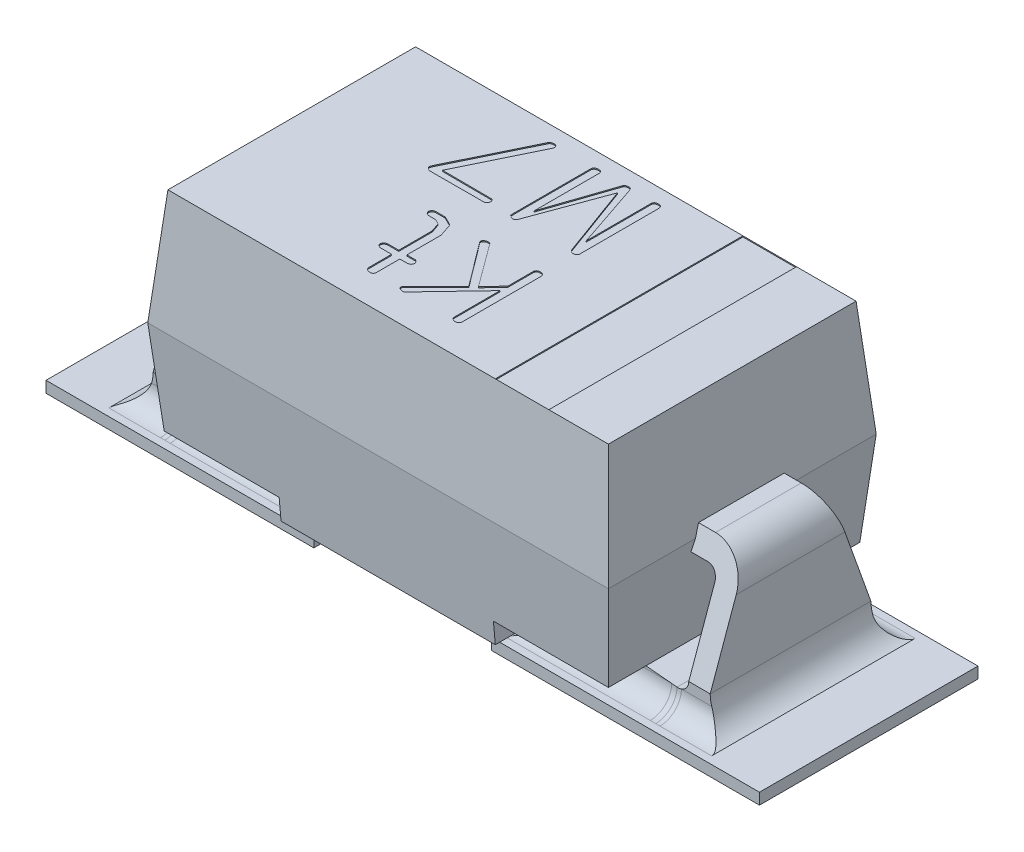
SolidWorks part; units mm, degrees
ref_plane "Front Plane" through (0, 0, 0) normal (0, 0, 1) x (1, 0, 0)
ref_plane "Top Plane" through (0, 0, 0) normal (0, 1, 0) x (1, 0, 0)
ref_plane "Right Plane" through (0, 0, 0) normal (1, 0, 0) x (0, 0, -1)
sketch "Sketch5" plane through (0, 0, 0) normal (0, 0, 1) x (1, 0, 0)
  line L2 (-2.3, 1.28) -> (2.3, 1.28)
  line L3 (2.5, 1.08) -> (2.5, 0.4)
  line L4 (2.2817, 0.2008) -> (1.2, 0.3)
  line L5 (0, -1.193) -> (0, 1.193) construction
  line L6 (1.375, 0) -> (-1.375, 0) construction
  line L7 (2.3, 0.4) -> (2.3, 0.2) construction
  line L10 (-2.5, 1.08) -> (-2.5, 0.4)
  line L11 (-2.2817, 0.2008) -> (-1.2, 0.3)
  arc A0 (2.3, 1.28) -> (2.5, 1.08) centre (2.3, 1.08) cw
  arc A1 (2.5, 0.4) -> (2.2817, 0.2008) centre (2.3, 0.4) cw
  arc A2 (-2.5, 0.4) -> (-2.2817, 0.2008) centre (-2.3, 0.4) ccw
  arc A4 (-2.3, 1.28) -> (-2.5, 1.08) centre (-2.3, 1.08) ccw
  point P15 (2.5, 0.1808)
  dimension "D8" = 0.2
  dimension "D1" = 0.2
  dimension "D2" = 2.5
  dimension "D3" = 1.28
  dimension "D4" = 0.2
  dimension "D5" = 0.3
  dimension "D6" = 1.3
  dimension "D7" = 5
  dimension "D9" = 1.3
ref_plane "Plane4" through (1.2, 0.3, 0) normal (-0.9958, 0.0913, 0) x (0, 0, 1)
sketch "Sketch10" plane through (1.2, 0.3, 0) normal (-0.9958, 0.0913, 0) x (0, 0, 1)
  line L0 (-0.75, 0) -> (0.75, 0) construction
  line L2 (-0.75, 0.1) -> (0.75, 0.1)
  line L3 (-0.75, 0.1) -> (-0.75, -0.1)
  line L4 (-0.75, -0.1) -> (0.75, -0.1)
  line L5 (0.75, 0.1) -> (0.75, -0.1)
  dimension "D1" = 0.2
  dimension "D2" = 1.5
sketch "Sketch2" plane through (0, 0, 0) normal (0, 0, 1) x (1, 0, 0)
  line L0 (-2.15, 1.275) -> (-2.0559, 2.35)
  line L2 (-2.15, 1.275) -> (-2.0734, 0.4)
  line L4 (-2.0559, 2.35) -> (2.0559, 2.35)
  line L5 (-2.15, 1.275) -> (2.15, 1.275) construction
  line L7 (2.15, 1.275) -> (2.0559, 2.35)
  line L8 (-1, 0.2) -> (1, 0.2)
  line L9 (2.75, 0) -> (-2.75, 0) construction
  line L11 (2.0734, 0.4) -> (2.15, 1.275)
  line L12 (2.0734, 0.4) -> (1, 0.4)
  line L13 (1, 0.4) -> (1, 0.2)
  line L16 (-2.0734, 0.4) -> (-1, 0.4)
  line L17 (-1, 0.4) -> (-1, 0.2)
  line L19 (0, -0.6045) -> (0, 0.6045) construction
  dimension "D1" = 1.275
  dimension "D2" = 5
  dimension "D3" = 5
  dimension "D4" = 2.35
  dimension "D5" = 0.2
  dimension "D6" = 2
  dimension "D7" = 1
  dimension "D8" = 4.3
  dimension "D9" = 2.15
  dimension "D10" = 0.2
sweep "Sweep3" add profiles "Sketch10" path "Sketch5"
sketch "Sketch14" plane through (0, 0, 0) normal (1, 0, 0) x (0, 0, -1)
  line L0 (-0.75, 0.4) -> (-0.4, 1.38)
  line L1 (0.75, 1.38) -> (-0.75, 1.38) construction
  line L2 (-0.4, 1.38) -> (-0.75, 1.38)
  line L3 (-0.75, 1.38) -> (-0.75, 0.4)
  line L5 (0.4, 1.38) -> (0.75, 1.38)
  line L6 (0.75, 1.38) -> (0.75, 0.4)
  line L7 (0.75, 0.4) -> (0.4, 1.38)
  line L8 (0, 1.275) -> (0, 2.35) construction
  dimension "D1" = 0.8
  dimension "D2" = 0.4
extrude "Cut-Extrude4" cut sketch "Sketch14" against normal through all and the other way through all
extrude "Boss-Extrude2" add sketch "Sketch2" along normal mid plane 2.5
sketch "Sketch1" plane through (0, 0, 0) normal (1, 0, 0) x (0, 0, -1)
  line L0 (1.25, 0.4) -> (1.25, 1.275) construction
  line L1 (0, 0.6045) -> (0, -0.6045) construction
  line L3 (-1.25, 1.275) -> (-1.1559, 0.2)
  line L4 (2.75, 0) -> (-2.75, 0) construction
  line L5 (1.1559, 0.2) -> (1.25, 1.275)
  line L6 (1.25, 1.275) -> (1.1559, 2.35)
  line L7 (-1.25, 2.35) -> (1.25, 2.35) construction
  line L8 (-1.1559, 2.35) -> (-1.25, 1.275)
  line L9 (-1.25, 0.2) -> (1.25, 0.2) construction
  line L10 (1.1559, 2.35) -> (1.35, 2.35)
  line L11 (1.35, 2.35) -> (1.35, 0.2)
  line L12 (1.35, 0.2) -> (1.1559, 0.2)
  line L13 (-1.1559, 2.35) -> (-1.35, 2.35)
  line L14 (-1.35, 2.35) -> (-1.35, 0.2)
  line L15 (-1.35, 0.2) -> (-1.1559, 0.2)
  dimension "D1" = 2.5
  dimension "D2" = 1.25
  dimension "D3" = 1.275
  dimension "D4" = 0.1
  dimension "D5" = 0.1
  dimension "D6" = 5
  dimension "D7" = 5
extrude "Cut-Extrude5" cut sketch "Sketch1" against normal through all and the other way through all
sketch "Sketch15" plane through (0, 0, 0) normal (0, 1, 0) x (1, 0, 0)
  line L0 (0, -1.2375) -> (0, 1.2375) construction
  line L1 (-3.33, 1.02) -> (-0.83, 1.02)
  line L2 (-3.33, 1.02) -> (-3.33, -1.02)
  line L3 (-3.33, -1.02) -> (-0.83, -1.02)
  line L4 (-0.83, 1.02) -> (-0.83, -1.02)
  line L5 (0.83, 1.02) -> (3.33, 1.02)
  line L6 (0.83, 1.02) -> (0.83, -1.02)
  line L7 (0.83, -1.02) -> (3.33, -1.02)
  line L8 (3.33, 1.02) -> (3.33, -1.02)
  line L9 (-2.2817, 0) -> (-1.2, 0) construction
  dimension "D1" = 0.83
  dimension "D2" = 0.83
  dimension "D3" = 2.5
  dimension "D4" = 2.04
  dimension "D5" = 1.02
extrude "Boss-Extrude4" add sketch "Sketch15" along normal blind 0.105
sketch "Sketch16" plane through (0, 0, 0) normal (0, 0, 1) x (1, 0, 0)
  line L0 (0.83, 0) -> (2.83, 0)
  line L1 (1.375, 0) -> (-1.375, 0) construction
  line L2 (2.83, 0) -> (2.83, 0.1)
  line L3 (0.83, 0) -> (0.83, 0.1)
  line L4 (0, -1.2925) -> (0, 1.2925) construction
  line L5 (2.2817, 0.2008) -> (1.2, 0.3) construction
  line L6 (-0.83, 0.1) -> (-0.83, 0)
  line L8 (-2.83, 0) -> (-0.83, 0)
  line L9 (-2.83, 0) -> (-2.83, 0.1)
  line L11 (-1.1909, 0.2004) -> (-1.2091, 0.3996) construction
  arc A0 (2.83, 0.1) -> (2.6, 0.4) centre (2.9107, 0.4) cw
  arc A1 (2.6, 0.4) -> (1.2, 0.3) centre (1.8015, 1.7285) cw
  arc A2 (1.2, 0.3) -> (0.83, 0.1) centre (0.83, 0.5423) cw
  arc A3 (-2.83, 0.1) -> (-2.6, 0.4) centre (-2.9107, 0.4) ccw
  arc A4 (-1.2, 0.3) -> (-0.83, 0.1) centre (-0.83, 0.5423) ccw
  arc A5 (-2.6, 0.4) -> (-1.2, 0.3) centre (-1.8015, 1.7285) ccw
  dimension "D4" = 0.3107
  dimension "D5" = 1.55
  dimension "D6" = 1.55
  dimension "D1" = 0.1
  dimension "D2" = 0.83
  dimension "D3" = 2
  dimension "D7" = 0.1
  dimension "D8" = 2
  dimension "D9" = 0.83
extrude "Boss-Extrude8" add sketch "Sketch16" along normal mid plane 1.5
fillet "Fillet2" radius 0.2 4 edges at (1.8548, 0.105, -0.75) (-1.8548, 0.105, -0.75) (1.8548, 0.105, 0.75) (-1.8548, 0.105, 0.75)
sketch "Sketch19" plane through (0, 2.35, 0) normal (0, 1, 0) x (1, 0, 0)
  line L0 (-2.0559, 1.1559) -> (2.0559, 1.1559) construction
  line L1 (1, 1.1559) -> (1.5, 1.1559)
  line L2 (1, 1.1559) -> (1, -1.1559)
  line L3 (1, -1.1559) -> (1.5, -1.1559)
  line L4 (1.5, 1.1559) -> (1.5, -1.1559)
  line L5 (-2.0559, -1.1559) -> (2.0559, -1.1559) construction
  line L6 (0, -1.2925) -> (0, 1.2925) construction
  dimension "D1" = 0.5
  dimension "D2" = 1.5
extrude "Cut-Extrude6" cut sketch "Sketch19" against normal blind 0.01
sketch "Sketch20" plane through (0, 2.35, 0) normal (0, 1, 0) x (1, 0, 0)
  line L0 (0.5, 1) -> (-1.3, 1) construction
  line L1 (0.5, -0.1) -> (-1.3, -0.1) construction
  line L2 (0, -1.2925) -> (0, 1.2925) construction
  line L3 (-1.2925, 0) -> (1.2925, 0) construction
  text T0 "Kt" font "SWRomns" height 0.8
  text T1 "M7" font "SWRomns" height 0.8
  dimension "D1" = 0.5
  dimension "D2" = 0.5
  dimension "D3" = 0.1
  dimension "D4" = 1
  dimension "D5" = 1.8
extrude "Cut-Extrude7" cut sketch "Sketch20" against normal blind 0.01
